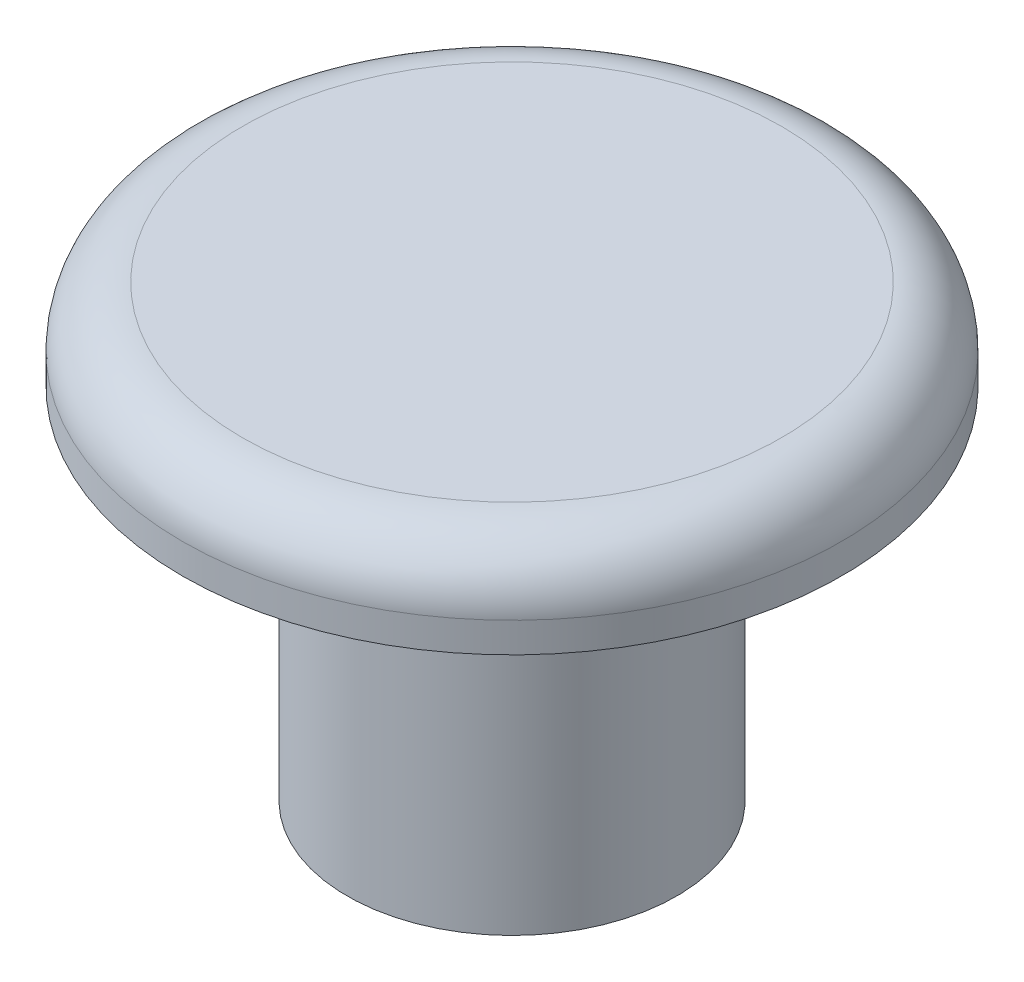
SolidWorks part; units mm, degrees
ref_plane "Front Plane" through (0, 0, 0) normal (0, 0, 1) x (1, 0, 0)
ref_plane "Top Plane" through (0, 0, 0) normal (0, 1, 0) x (1, 0, 0)
ref_plane "Right Plane" through (0, 0, 0) normal (1, 0, 0) x (0, 0, -1)
sketch "Sketch1" plane through (0, 0, 0) normal (0, 0, 1) x (1, 0, 0)
  line L0 (0, 0) -> (0, 49.101) construction
  line L1 (0, 0) -> (5.5, 0)
  line L2 (5.5, 0) -> (5.5, 12)
  line L3 (5.5, 12) -> (11, 12)
  line L4 (11, 15) -> (0, 15)
  line L5 (0, 15) -> (0, 0)
  line L6 (11, 15) -> (11, 12)
  dimension "D4" = 3
  dimension "D1" = 11
  dimension "D2" = 12
  dimension "D3" = 22
revolve "Revolve1" add sketch "Sketch1" angle 360 about L0
fillet "Fillet1" radius 2 1 edges at (0, 15, -11)
